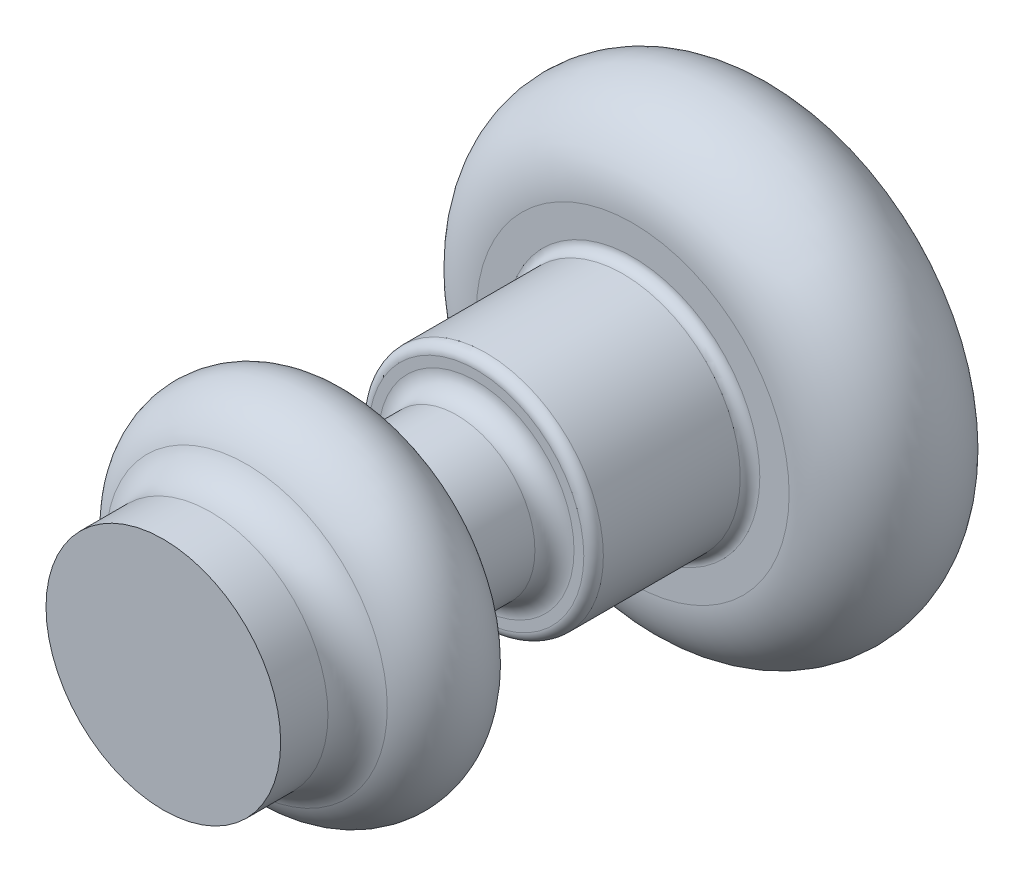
SolidWorks part; units mm, degrees
ref_plane "Front Plane" through (0, 0, 0) normal (0, 0, 1) x (1, 0, 0)
ref_plane "Top Plane" through (0, 0, 0) normal (0, 1, 0) x (1, 0, 0)
ref_plane "Right Plane" through (0, 0, 0) normal (1, 0, 0) x (0, 0, -1)
sketch "Sketch1" plane through (0, 0, 0) normal (0, 1, 0) x (1, 0, 0)
  line L0 (-28.05, 0) -> (-25.5, 0)
  line L1 (-20.4, -5.1) -> (-20.4, -20.4)
  line L2 (-30.6, -69.2711) -> (-30.6, -81.6)
  line L3 (-30.6, -81.6) -> (0, -81.6)
  line L8 (0, 81.6) -> (-40.8, 81.6)
  line L9 (-40.8, 40.8) -> (-33.15, 40.8)
  line L10 (-30.6, 2.55) -> (-30.6, 38.25)
  line L12 (0, -81.6) -> (0, 81.6) construction
  arc A0 (-30.6, 2.55) -> (-28.05, 0) centre (-28.05, 2.55) ccw
  arc A1 (-20.4, -5.1) -> (-25.5, 0) centre (-25.5, -5.1) ccw
  arc A2 (-30.6, -30.6) -> (-20.4, -20.4) centre (-30.6, -20.4) ccw
  arc A3 (-30.6, -30.6) -> (-36.72, -59.9227) centre (-30.6, -45.9) ccw
  arc A4 (-30.6, -69.2711) -> (-36.72, -59.9227) centre (-40.8, -69.2711) ccw
  arc A12 (-40.8, 81.6) -> (-40.8, 40.8) centre (-40.8, 61.2) ccw
  arc A13 (-30.6, 38.25) -> (-33.15, 40.8) centre (-33.15, 38.25) ccw
  dimension "D2" = 81.6
  dimension "D6" = 81.6
  dimension "D9" = 20.4
  dimension "D10" = 2.55
  dimension "D12" = 5.1
  dimension "D13" = 10.2
  dimension "D14" = 15.3
  dimension "D3" = 81.6
  dimension "D4" = 40.8
  dimension "D5" = 61.2
  dimension "D7" = 81.6
  dimension "D8" = 163.2
  dimension "D16" = 20.4
revolve "Revolve1" add sketch "Sketch1" angle 360 about L12
